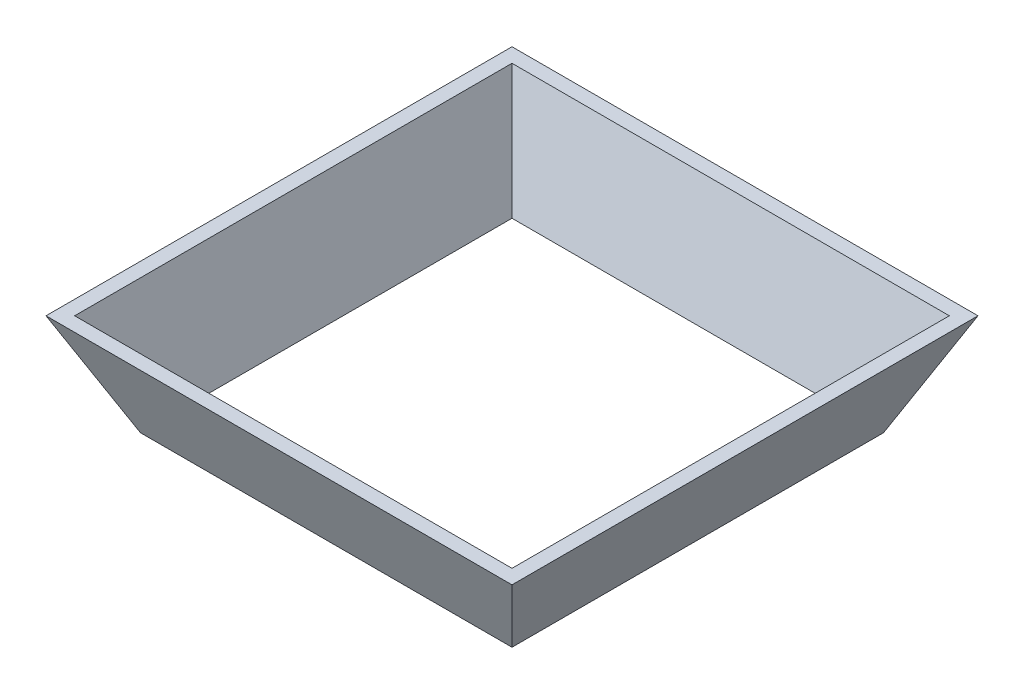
SolidWorks part; units mm, degrees
ref_plane "Front Plane" through (0, 0, 0) normal (0, 0, 1) x (1, 0, 0)
ref_plane "Top Plane" through (0, 0, 0) normal (0, 1, 0) x (1, 0, 0)
ref_plane "Right Plane" through (0, 0, 0) normal (1, 0, 0) x (0, 0, -1)
sketch "Sketch1" plane through (0, 0, 0) normal (0, 1, 0) x (1, 0, 0)
  line L1 (-27.5, -27.5) -> (27.5, -27.5)
  line L2 (-27.5, -27.5) -> (-27.5, 27.5)
  line L3 (-27.5, 27.5) -> (27.5, 27.5)
  line L4 (27.5, -27.5) -> (27.5, 27.5)
  line L5 (-27.5, -27.5) -> (27.5, 27.5) construction
  line L6 (-27.5, 27.5) -> (27.5, -27.5) construction
  point P0 (0, 0)
  dimension "D1" = 55
  dimension "D2" = 55
extrude "Boss-Extrude1" add sketch "Sketch1" along normal blind 15 draft 25
sketch "Sketch3" plane through (0, 0, 0) normal (0, -1, 0) x (1, 0, 0)
  line L1 (-27.5, -27.5) -> (27.5, -27.5)
  line L2 (-27.5, -27.5) -> (-27.5, 27.5)
  line L3 (-27.5, 27.5) -> (27.5, 27.5)
  line L4 (27.5, -27.5) -> (27.5, 27.5)
extrude "Cut-Extrude3" cut sketch "Sketch3" against normal blind 15 draft 18
